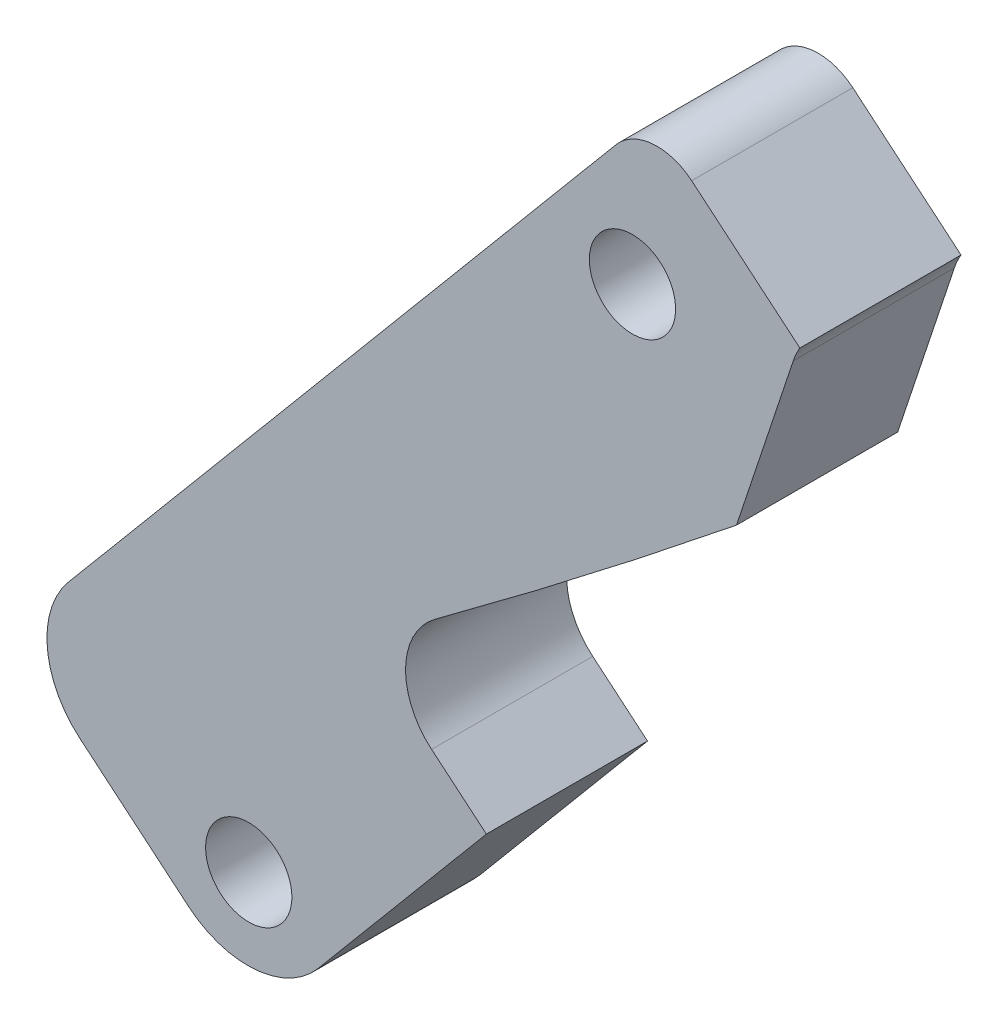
SolidWorks part; units mm, degrees
ref_plane "Front" through (0, 0, 0) normal (0, 0, 1) x (1, 0, 0)
ref_plane "Top" through (0, 0, 0) normal (0, 1, 0) x (1, 0, 0)
ref_plane "Right" through (0, 0, 0) normal (1, 0, 0) x (0, 0, -1)
ref_plane "Plane1"
sketch "Sketch1" plane through (0, 0, 3.2) normal (0, 0, -1) x (-1, 0, 0)
  line L0 (519.5546, -93.9665) -> (528.5538, -86.4153) construction
  line L1 (463.5125, -39.0326) -> (508.8193, -93.0272) construction
  line L2 (477.9238, -21.1375) -> (464.0603, -32.7703) construction
  line L3 (529.493, -75.68) -> (484.1861, -21.6854) construction
  line L4 (519.5546, -93.9665) -> (528.5538, -86.4153)
  line L5 (463.5125, -39.0326) -> (508.8193, -93.0272)
  line L6 (477.9238, -21.1375) -> (464.0603, -32.7703)
  line L7 (529.493, -75.68) -> (484.1861, -21.6854)
  arc A0 (528.5538, -86.4153) -> (529.493, -75.68) centre (523.6557, -80.578) ccw construction
  arc A1 (508.8193, -93.0272) -> (519.5546, -93.9665) centre (514.6566, -88.1292) ccw construction
  arc A2 (464.0603, -32.7703) -> (463.5125, -39.0326) centre (466.9175, -36.1754) ccw construction
  arc A3 (484.1861, -21.6854) -> (477.9238, -21.1375) centre (480.781, -24.5426) ccw construction
  arc A4 (528.5538, -86.4153) -> (529.493, -75.68) centre (523.6557, -80.578) ccw
  arc A5 (508.8193, -93.0272) -> (519.5546, -93.9665) centre (514.6566, -88.1292) ccw
  arc A6 (464.0603, -32.7703) -> (463.5125, -39.0326) centre (466.9175, -36.1754) ccw
  arc A7 (484.1861, -21.6854) -> (477.9238, -21.1375) centre (480.781, -24.5426) ccw
extrude "Boss-Extrude1" add sketch "Sketch1" against normal blind 13.335 flip side to cut
sketch "Sketch2" plane through (0, 0, 3.2) normal (0, 0, -1) x (-1, 0, 0)
  line L2 (474.2136, -43.9648) -> (469.5196, -29.8467)
  line L3 (458.0708, -33.6533) -> (462.7649, -47.7713)
  line L4 (474.2136, -43.9648) -> (469.5196, -29.8467)
  line L5 (458.0708, -33.6533) -> (462.7649, -47.7713)
  arc A5 (491.9958, -72.889) -> (499.1416, -63.1677) centre (495.5687, -68.0284) ccw
  arc A6 (474.2136, -43.9648) -> (499.1416, -63.1677) centre (912.9773, 499.8274) ccw
  arc A7 (469.5196, -29.8467) -> (458.0708, -33.6533) centre (463.7952, -31.75) ccw
  arc A8 (462.7649, -47.7713) -> (466.6375, -53.3545) centre (474.2136, -43.9648) ccw
  arc A9 (466.6375, -53.3545) -> (491.9958, -72.889) centre (912.9773, 499.8274) ccw
  arc A10 (491.9958, -72.889) -> (499.1416, -63.1677) centre (495.5687, -68.0284) ccw
  arc A11 (474.2136, -43.9648) -> (499.1416, -63.1677) centre (912.9773, 499.8274) ccw
  arc A12 (469.5196, -29.8467) -> (458.0708, -33.6533) centre (463.7952, -31.75) ccw
  arc A13 (462.7649, -47.7713) -> (466.6375, -53.3545) centre (474.2136, -43.9648) ccw
  arc A14 (466.6375, -53.3545) -> (491.9958, -72.889) centre (912.9773, 499.8274) ccw
  dimension "D1" = 0
extrude "Cut-Extrude1" cut sketch "Sketch2" against normal through all
sketch "Sketch3" plane through (0, 0, 16.535) normal (0, 0, 1) x (1, 0, 0)
  line L0 (-491.8014, -72.746) -> (-508.8193, -93.0272) construction
  line L1 (-491.8014, -72.746) -> (-494.9126, -76.4538)
  line L2 (-494.9126, -76.4538) -> (-499.4463, -72.6495)
  arc A0 (-499.1416, -63.1677) -> (-491.9958, -72.889) centre (-495.5687, -68.0284) ccw construction
  arc A1 (-499.4463, -72.6495) -> (-491.9958, -72.889) centre (-495.5687, -68.0284) ccw
  arc A2 (-491.9958, -72.889) -> (-491.8014, -72.746) centre (-912.9773, 499.8274) ccw construction
  arc A3 (-491.9958, -72.889) -> (-491.8014, -72.746) centre (-912.9773, 499.8274) ccw
extrude "Cut-Extrude2" cut sketch "Sketch3" against normal through all
hole_wizard "Hole1" positions "Point_Sketch" profile "Profil_Sketch" counterbore size "1/4" standard "ANSI Inch"
sketch "Point_Sketch" plane through (-469.9527, -30.0736, 3.2) normal (0, 0, 1) x (-1, 0, 0)
  point P0 (12.8691, 0.935)
  point P2 (44.6256, 58.9502)
sketch "Profil_Sketch" plane through (-482.8218, -31.0086, 3.2) normal (1, 0, 0) x (0, 1, 0)
  line L0 (0, 0) -> (0, 13.335)
  line L1 (0, 13.335) -> (3.5687, 13.335)
  line L3 (3.5687, 13.335) -> (3.5687, 7.874)
  line L4 (3.5687, 7.874) -> (5.3594, 7.874)
  line L5 (5.3594, 7.874) -> (5.3594, 0)
  line L7 (5.3594, 0) -> (0, 0)
  line L11 (0, -6.35) -> (0, 107.95) construction
  dimension "Diameter" = 7.1374
  dimension "Thru Hole Depth" = 13.335
  dimension "L1" = 7.874
other "usin_LS160_.25-20x.625-SHCS<1>"
